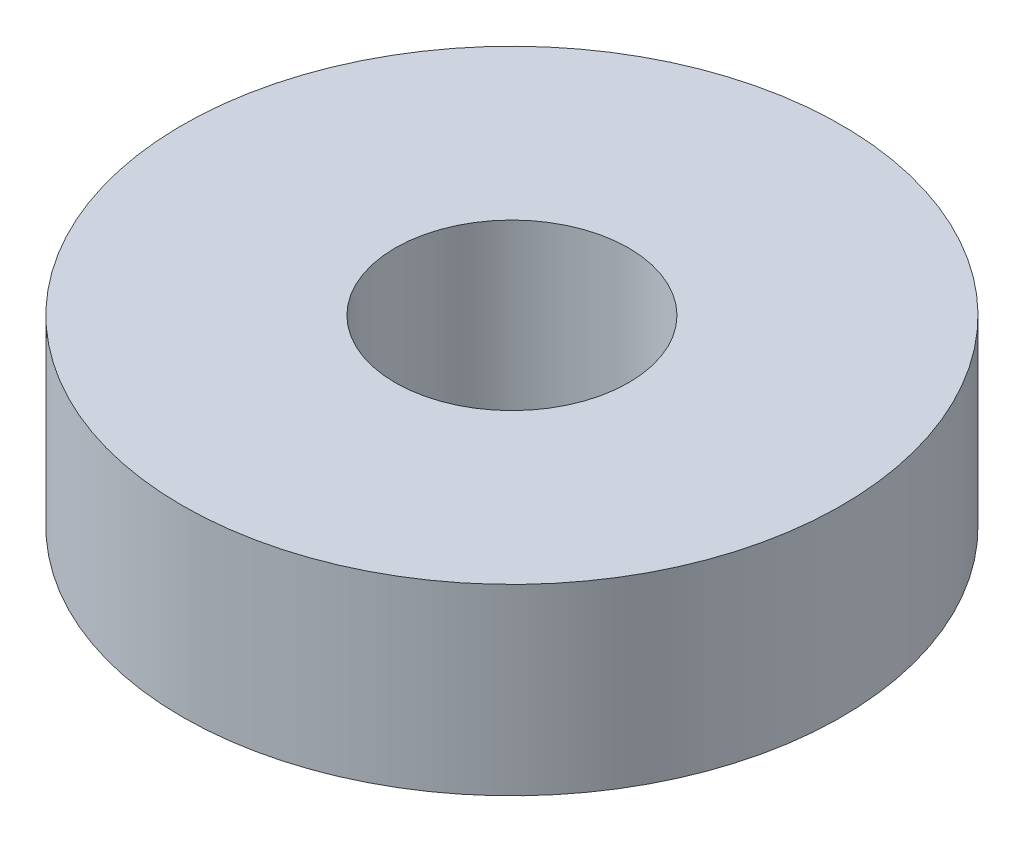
SolidWorks part; units mm, degrees
ref_plane "Front Plane" through (0, 0, 0) normal (0, 0, 1) x (1, 0, 0)
ref_plane "Top Plane" through (0, 0, 0) normal (0, 1, 0) x (1, 0, 0)
ref_plane "Right Plane" through (0, 0, 0) normal (1, 0, 0) x (0, 0, -1)
sketch "Sketch1" plane through (0, 0, 0) normal (0, 1, 0) x (1, 0, 0)
  circle A0 centre (0, 0) radius 3.2385
  circle A1 centre (0, 0) radius 9.144
  dimension "D1" = 6.477
  dimension "D2" = 18.288
extrude "Boss-Extrude1" add sketch "Sketch1" along normal blind 5.08
